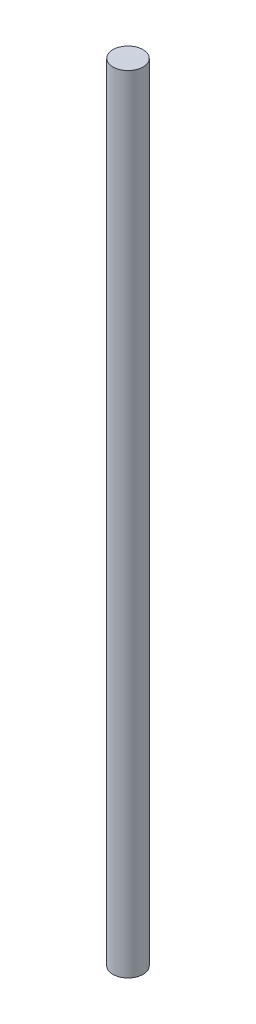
SolidWorks part; units mm, degrees
ref_plane "Plan de face" through (0, 0, 0) normal (0, 0, 1) x (1, 0, 0)
ref_plane "Plan de dessus" through (0, 0, 0) normal (0, 1, 0) x (1, 0, 0)
ref_plane "Plan de droite" through (0, 0, 0) normal (1, 0, 0) x (0, 0, -1)
sketch "Esquisse1" plane through (0, 0, 0) normal (0, 1, 0) x (1, 0, 0)
  circle A0 centre (0, 0) radius 2
  dimension "D1" = 4
extrude "Boss.-Extru.1" add sketch "Esquisse1" along normal mid plane 104.5
